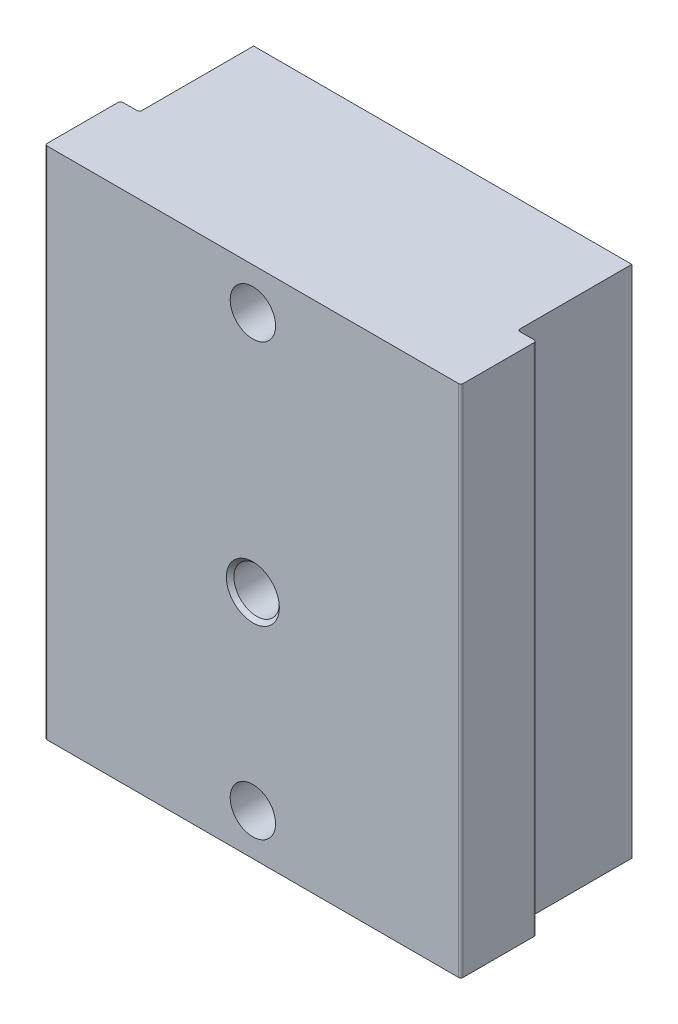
SolidWorks part; units mm, degrees
ref_plane "Plan de face" through (0, 0, 0) normal (0, 0, 1) x (1, 0, 0)
ref_plane "Plan de dessus" through (0, 0, 0) normal (0, 1, 0) x (1, 0, 0)
ref_plane "Plan de droite" through (0, 0, 0) normal (1, 0, 0) x (0, 0, -1)
sketch "Esquisse1" plane through (0, 0, 0) normal (0, 1, 0) x (1, 0, 0)
  line L0 (0, 0) -> (0, 25.1) construction
  line L1 (-25, 25.1) -> (25, 25.1)
  line L2 (-27.5, 10) -> (-27.5, 0)
  line L3 (-27.5, 0) -> (27.5, 0)
  line L4 (27.5, 10) -> (27.5, 0)
  line L8 (-27.5, 10) -> (-25, 10)
  line L9 (-25, 25.1) -> (-25, 10)
  line L12 (27.5, 10) -> (25, 10)
  line L13 (25, 25.1) -> (25, 10)
  dimension "D1" = 25.1
  dimension "D2" = 55
  dimension "D3" = 10
  dimension "D4" = 50
extrude "section profilé" add sketch "Esquisse1" along normal blind 68
fillet "Congé1" radius 0.3 6 edges at (27.5, 34, -10) (25, 34, -10) (-25, 34, -10) (-27.5, 34, -10) (27.5, 34, 0) (-27.5, 34, 0)
sketch "Esquisse3" plane through (0, 0, -25.1) normal (0, 0, -1) x (-1, 0, 0)
  line L0 (0, 0) -> (0, 68) construction
  line L1 (-25, 68) -> (25, 68) construction
  line L2 (-25, 0) -> (25, 0) construction
  circle A0 centre (0, 62.5) radius 3
  circle A1 centre (0, 5.5) radius 3
  dimension "D1" = 57
  dimension "D2" = 6
  dimension "D3" = 6
  dimension "D4" = 5.5
extrude "Enlèv. mat.-Extru.1" cut sketch "Esquisse3" against normal through all
sketch "Esquisse4" [suppressed] plane through (0, 0, -25.1) normal (0, 0, -1) x (-1, 0, 0)
  line L0 (-25, 0) -> (25, 0) construction
  circle A0 centre (-11, 62.5) radius 3
  circle A1 centre (11, 5.5) radius 3
  dimension "D1" = 11
  dimension "D2" = 11
  dimension "D5" = 6
  dimension "D3" = 57
  dimension "D4" = 5.5
extrude "Enlèv. mat.-Extru.2" [suppressed] cut sketch "Esquisse4" against normal through all
sketch "Esquisse5" plane through (0, 0, -25.1) normal (0, 0, -1) x (-1, 0, 0)
  line L0 (-25, 0) -> (25, 0) construction
  circle A0 centre (0, 30.5) radius 1.5
  dimension "D1" = 3
  dimension "D2" = 30.5
extrude "Enlèv. mat.-Extru.3" cut sketch "Esquisse5" against normal through all
sketch "Esquisse6" plane through (0, 0, 0) normal (0, 0, 1) x (1, 0, 0)
  circle A0 centre (0, 30.5) radius 3
  circle A1 centre (0, 30.5) radius 1.5 construction
  dimension "D1" = 6
extrude "Enlèv. mat.-Extru.4" cut sketch "Esquisse6" against normal blind 10
chamfer "Chanfrein1" distance 0.5 angle 45 1 edges at (3, 30.5, 0)
sketch "Esquisse7" [suppressed] plane through (0, 0, -25.1) normal (0, 0, -1) x (-1, 0, 0)
  circle A0 centre (0, 5.5) radius 1.5
  dimension "D1" = 5.5
  dimension "D2" = 3
extrude "Enlèv. mat.-Extru.5" [suppressed] cut sketch "Esquisse7" against normal through all
sketch "Esquisse8" [suppressed] plane through (0, 0, 0) normal (0, 0, 1) x (1, 0, 0)
  circle A0 centre (0, 5.5) radius 3
  circle A1 centre (0, 5.5) radius 1.5 construction
  dimension "D1" = 6
extrude "Enlèv. mat.-Extru.6" [suppressed] cut sketch "Esquisse8" against normal blind 10
chamfer "Chanfrein2" [suppressed] distance 0.2 angle 45
